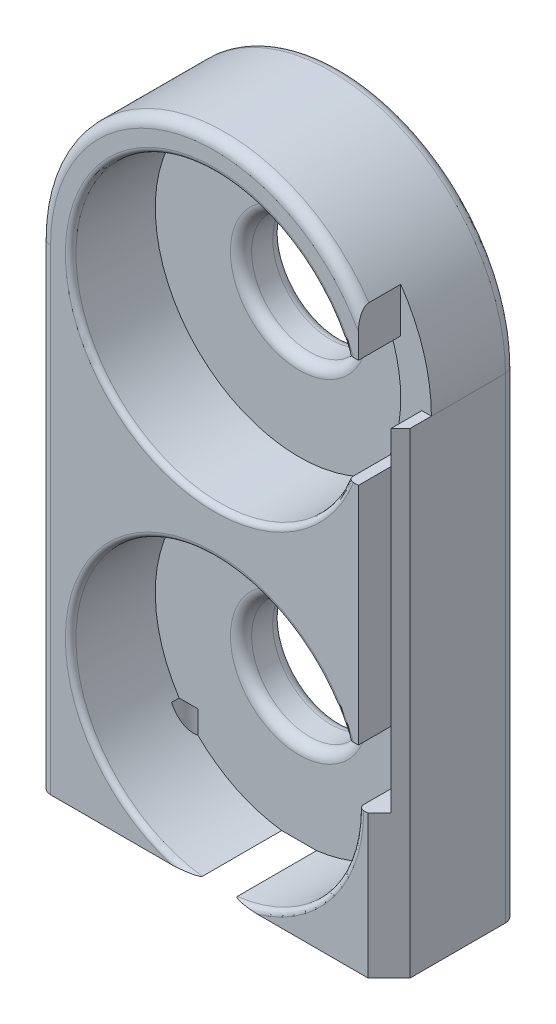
SolidWorks part; units mm, degrees
ref_plane "Plano frontal" through (0, 0, 0) normal (0, 0, 1) x (1, 0, 0)
ref_plane "Plano superior" through (0, 0, 0) normal (0, 1, 0) x (1, 0, 0)
ref_plane "Plano direito" through (0, 0, 0) normal (1, 0, 0) x (0, 0, -1)
sketch "Esboço1" plane through (0, 0, 0) normal (0, 0, 1) x (1, 0, 0)
  line L2 (-16.5, 0) -> (-16.5, 45)
  line L3 (16.5, 45) -> (16.5, 0)
  line L7 (0, 0) -> (0, 13.5) construction
  line L8 (0, 13.5) -> (0, 45) construction
  line L10 (-16.5, 0) -> (16.5, 0)
  arc A0 (-16.5, 45) -> (16.5, 45) centre (0, 45) cw
  circle A1 centre (0, 13.5) radius 9 construction
  circle A2 centre (0, 45) radius 9 construction
  circle A3 centre (0, 45) radius 5.5
  circle A4 centre (0, 13.5) radius 5.5
  dimension "D5" = 18
  dimension "D7" = 18
  dimension "D8" = 11
  dimension "D9" = 11
  dimension "D1" = 33
  dimension "D4" = 13.5
  dimension "D6" = 31.5
extrude "Ressalto-extrusão1" add sketch "Esboço1" along normal blind 12
sketch "Esboço2" plane through (0, 0, 12) normal (0, 0, 1) x (1, 0, 0)
  line L0 (0, 45) -> (0, 58.6) construction
  circle A0 centre (0, 45) radius 13.6
  circle A1 centre (0, 13.5) radius 13.6
  dimension "D1" = 27.2
  dimension "D2" = 27.2
extrude "Corte-extrusão1" cut sketch "Esboço2" against normal blind 8
sketch "Esboço4" plane through (0, 0, 0) normal (0, 0, -1) x (-1, 0, 0)
  line L0 (0, 45) -> (0, 54) construction
  line L1 (0, 13.5) -> (0, 22.5) construction
  line L2 (0, 45) -> (7.7942, 40.5) construction
  line L3 (0, 45) -> (-7.7942, 40.5) construction
  line L4 (0, 13.5) -> (7.7942, 9) construction
  line L5 (0, 13.5) -> (-7.7942, 9) construction
  dimension "D1" = 9
  dimension "D2" = 9
  dimension "D3" = 3
  dimension "D4" = 3
sketch "Esboço5" plane through (0, 0, 12) normal (0, 0, 1) x (1, 0, 0)
  line L4 (15.6, 13.5) -> (15.6, 45)
  line L5 (15.6, 54.3429) -> (13.6, 54.3429)
  line L6 (13.6, 54.3429) -> (13.6, 50.1186)
  line L7 (12.6, 50.1186) -> (13.6, 50.1186)
  line L8 (12.6, 50.1186) -> (12.6, 39.8814)
  line L9 (12.6, 39.8814) -> (13.6, 39.8814)
  line L10 (13.6, 39.8814) -> (13.6, 18.6186)
  line L11 (13.6, 18.6186) -> (12.6, 18.6186)
  line L12 (12.6, 18.6186) -> (12.6, 13.5)
  line L14 (12.6, 13.5) -> (13.6, 13.5)
  line L15 (13.6, 13.5) -> (15.6, 13.5)
  line L16 (0, 13.5) -> (13.6, 13.5) construction
  line L17 (15.6, 50.3749) -> (17.6, 50.3749)
  line L18 (17.6, 50.3749) -> (17.6, 45)
  line L19 (17.6, 45) -> (16.5, 45)
  line L20 (16.5, 45) -> (15.6, 45)
  line L21 (15.6, 50.3749) -> (15.6, 54.3429)
  circle A1 centre (0, 45) radius 13.6 construction
  circle A3 centre (0, 13.5) radius 13.6 construction
  arc A4 (16.5, 45) -> (-16.5, 45) centre (0, 45) ccw construction
  circle A5 centre (0, 45) radius 13.6 construction
  circle A6 centre (0, 13.5) radius 13.6 construction
  dimension "D1" = 2
  dimension "D2" = 1
  dimension "D3" = 1
  dimension "D4" = 2
  dimension "D5" = 1
  dimension "D6" = 1
  dimension "D7" = 2
extrude "Corte-extrusão2" cut sketch "Esboço5" against normal offset from surface (4 mm away) 4
fillet "Filete7" radius 1 9 edges at (-16.5, 22.5, 12) (16.5, 22.5, 0) (0, 61.5, 0) (5.5, 45, 4) (5.5, 45, 0) (5.5, 13.5, 4) (5.5, 13.5, 0) (-4.8913, 60.7583, 12) (-16.5, 22.5, 0)
fillet "Filete9" radius 0.5 3 edges at (-13.6, 45, 12) (10.1821, 4.4841, 12) (-10.8009, 21.7644, 12)
sketch "Esboço6" plane through (0, 0, 0) normal (0, -1, 0) x (1, 0, 0)
  line L0 (-15.5, 0) -> (15.5, 0) construction
  line L1 (-11, 3) -> (11, 3) construction
  line L2 (-14, 9) -> (14, 9) construction
  line L5 (-15.5, 12) -> (-4.0694, 12) construction
  circle A0 centre (-14, 9) radius 1.75
  circle A1 centre (14, 9) radius 1.75
  circle A2 centre (11, 3) radius 1.75
  circle A3 centre (-11, 3) radius 1.75
  point P0 (-11, 3)
  point P1 (11, 3)
  point P2 (14, 9)
  point P3 (-14, 9)
  point P4 (0, 3)
  point P13 (0, 9)
  dimension "D6" = 3.5
  dimension "D1" = 3
  dimension "D2" = 22
  dimension "D3" = 28
  dimension "D4" = 3
extrude "Corte-extrusão3" cut sketch "Esboço6" against normal blind 6
chamfer "Chanfro1" distance 2 angle 45 1 edges at (16.5, 22.5, 12)
